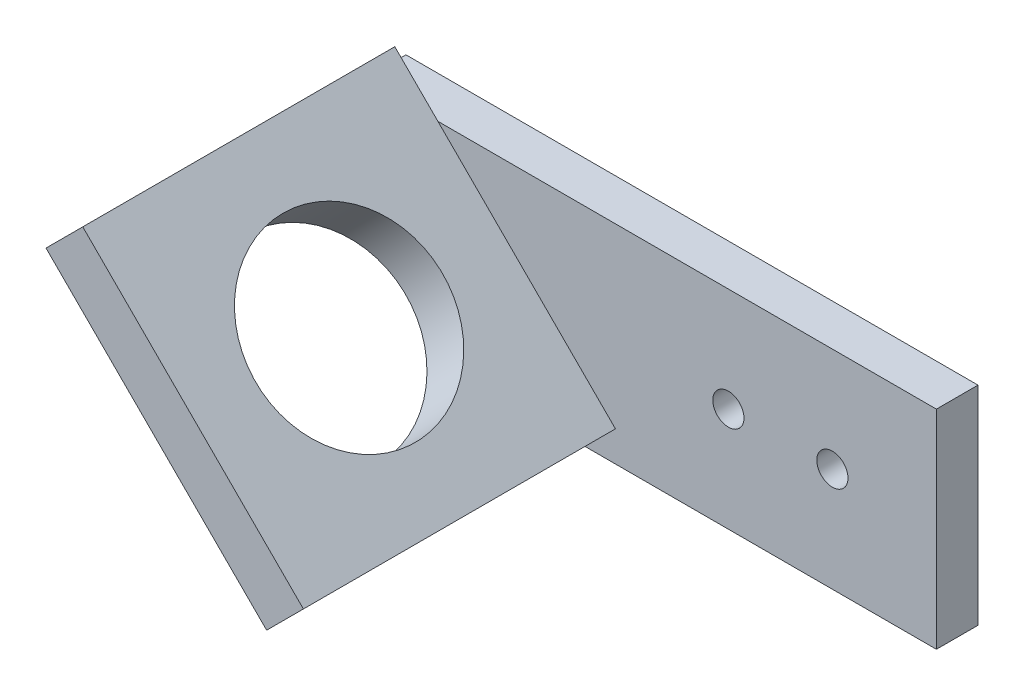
SolidWorks part; units mm, degrees
ref_plane "前视基准面" through (0, 0, 0) normal (0, 0, 1) x (1, 0, 0)
ref_plane "上视基准面" through (0, 0, 0) normal (0, 1, 0) x (1, 0, 0)
ref_plane "右视基准面" through (0, 0, 0) normal (1, 0, 0) x (0, 0, -1)
sketch "草图1" plane through (0, 0, 0) normal (0, 0, 1) x (1, 0, 0)
  line L1 (-40, 10) -> (40, 10)
  line L2 (-40, 10) -> (-40, -10)
  line L3 (-40, -10) -> (40, -10)
  line L4 (40, 10) -> (40, -10)
  line L5 (-40, 10) -> (40, -10) construction
  line L6 (-40, -10) -> (40, 10) construction
  point P0 (0, 0)
  dimension "D1" = 20
  dimension "D2" = 80
extrude "凸台-拉伸1" add sketch "草图1" along normal blind 4
sketch "草图2" plane through (0, 0, 4) normal (0, 0, 1) x (1, 0, 0)
  line L0 (-15.6066, 10.6066) -> (5.6066, -10.6066)
  line L1 (40, 10) -> (-40, 10) construction
  line L3 (5.6066, -10.6066) -> (9.1421, -7.0711)
  line L4 (9.1421, -7.0711) -> (-12.0711, 14.1421)
  line L5 (-12.0711, 14.1421) -> (-15.6066, 10.6066)
  line L6 (-40, 0) -> (40, 0) construction
  line L7 (-40, 10) -> (-40, -10) construction
  line L8 (40, -10) -> (40, 10) construction
  point P12 (-5, 0)
  dimension "D1" = 135
  dimension "D2" = 30
  dimension "D3" = 35
extrude "凸台-拉伸2" add sketch "草图2" along normal blind 30
sketch "草图3" plane through (1.0355, 1.0355, 0) normal (0.7071, 0.7071, 0) x (0, 0, -1)
  line L0 (-34, 18.5355) -> (-4, -11.4645) construction
  circle A0 centre (-19, 3.5355) radius 9
  dimension "D1" = 18
extrude "切除-拉伸1" cut sketch "草图3" against normal blind 20
sketch "草图4" plane through (0, 0, 4) normal (0, 0, 1) x (1, 0, 0)
  line L0 (40, 0) -> (0, 0) construction
  line L1 (40, -10) -> (40, 10) construction
  circle A0 centre (30, 0) radius 1.5
  circle A1 centre (20, 0) radius 1.5
  dimension "D1" = 3
  dimension "D2" = 3
  dimension "D3" = 10
  dimension "D4" = 10
extrude "切除-拉伸2" cut sketch "草图4" against normal blind 20
sketch "草图5" plane through (0, 0, 4) normal (0, 0, 1) x (1, 0, 0)
  line L0 (0, -5) -> (14.6162, -19.6162)
  line L1 (-15, 10) -> (5, -10) construction
  line L2 (14.6162, -19.6162) -> (-46.6705, -16.2306)
  line L3 (-46.6705, -16.2306) -> (-45.0935, 12.3171)
  line L4 (-45.0935, 12.3171) -> (-15.6066, 10.6066)
  line L5 (-15.6066, 10.6066) -> (0, -5)
extrude "切除-拉伸3" cut sketch "草图5" against normal blind 10
